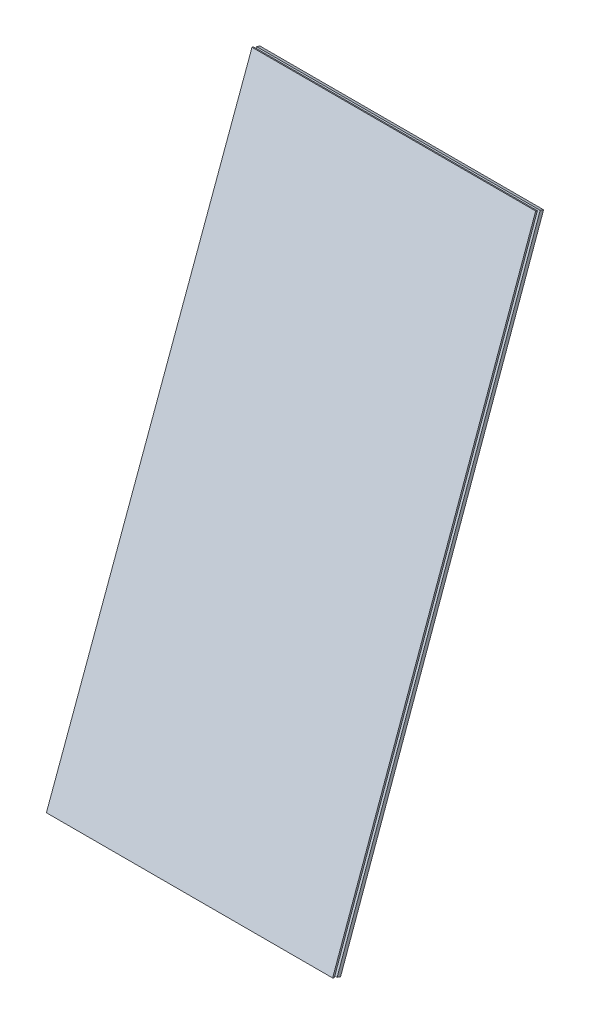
SolidWorks part; units mm, degrees
ref_plane "Front" through (0, 0, 0) normal (0, 0, 1) x (1, 0, 0)
ref_plane "Top" through (0, 0, 0) normal (0, 1, 0) x (1, 0, 0)
ref_plane "Right" through (0, 0, 0) normal (1, 0, 0) x (0, 0, -1)
ref_plane "Plane1" through (0, 2.0521, 5.6382) normal (0, 0.342, 0.9397) x (1, 0, 0)
sketch "Sketch2" plane through (0, 2.0521, 5.6382) normal (0, 0.342, 0.9397) x (1, 0, 0)
  line L4 (0, 0) -> (1557, 0)
  line L5 (1557, 0) -> (1550, 3249.9925)
  line L6 (1550, 3249.9925) -> (7, 3249.9925)
  line L7 (7, 3249.9925) -> (0, 0)
  line L8 (0, 0) -> (1557, 0)
  line L9 (1557, 0) -> (1550, 3249.9925)
  line L10 (1550, 3249.9925) -> (7, 3249.9925)
  line L11 (7, 3249.9925) -> (0, 0)
  dimension "D1" = 0
extrude "Boss-Extrude1" add sketch "Sketch2" along normal blind 20
ref_plane "Plane2" through (0, 14.3648, 39.4671) normal (0, 0.342, 0.9397) x (1, 0, 0)
sketch "Sketch3" plane through (0, 14.3648, 39.4671) normal (0, 0.342, 0.9397) x (1, 0, 0)
  line L4 (0, 0) -> (1557, 0)
  line L5 (1557, 0) -> (1550, 3249.9925)
  line L6 (1550, 3249.9925) -> (7, 3249.9925)
  line L7 (7, 3249.9925) -> (0, 0)
  line L8 (0, 0) -> (1557, 0)
  line L9 (1557, 0) -> (1550, 3249.9925)
  line L10 (1550, 3249.9925) -> (7, 3249.9925)
  line L11 (7, 3249.9925) -> (0, 0)
  dimension "D1" = 0
extrude "Boss-Extrude2" add sketch "Sketch3" along normal blind 10 separate body
